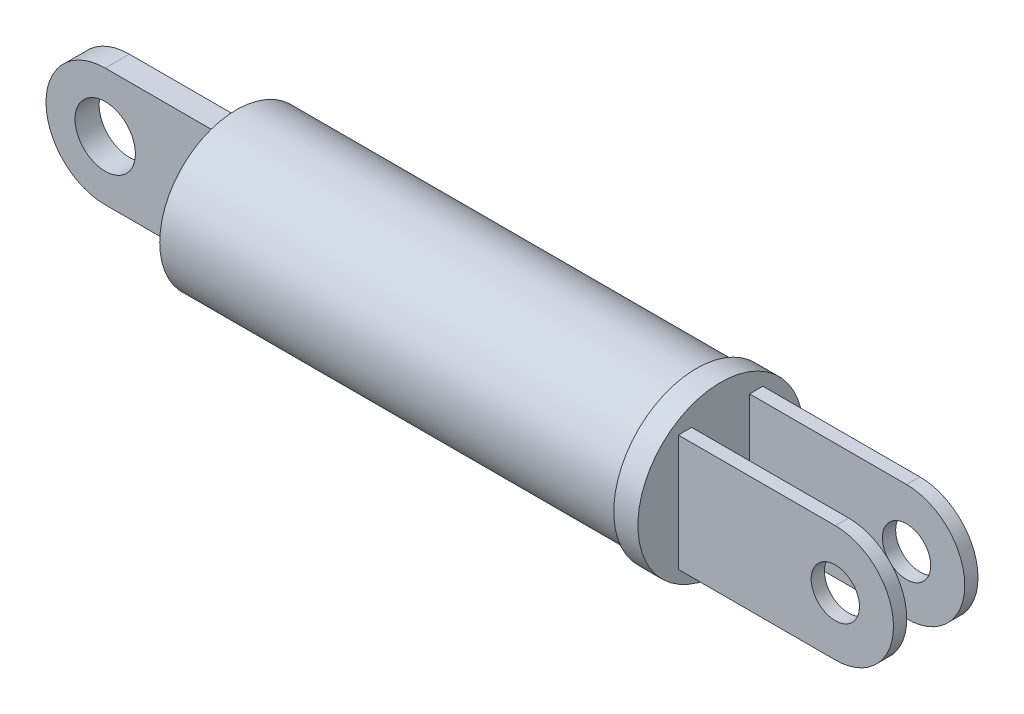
SolidWorks part; units mm, degrees
ref_plane "Front Plane" through (0, 0, 0) normal (0, 0, 1) x (1, 0, 0)
ref_plane "Top Plane" through (0, 0, 0) normal (0, 1, 0) x (1, 0, 0)
ref_plane "Right Plane" through (0, 0, 0) normal (1, 0, 0) x (0, 0, -1)
sketch "Sketch1" plane through (0, 0, 0) normal (1, 0, 0) x (0, 0, -1)
  circle A0 centre (0, 0) radius 12.7
  dimension "D1" = 25.4
extrude "Extrude1" add sketch "Sketch1" along normal blind 76.2
sketch "Sketch2" plane through (0, 0, 0) normal (0, 0, 1) x (1, 0, 0)
  line L0 (0, 0) -> (-32.8673, 0) construction
  line L1 (15.07, 0) -> (-15.07, 0) construction
  line L2 (0, 9.8057) -> (-19.7331, 9.8057)
  line L3 (0, 12.7) -> (0, -12.7) construction
  line L4 (0, -9.8057) -> (-19.7331, -9.8057)
  line L5 (0, 9.8057) -> (0, -9.8057)
  arc A0 (-19.7331, 9.8057) -> (-19.7331, -9.8057) centre (-19.7331, 0) ccw
  circle A1 centre (-19.7331, 0) radius 5
  dimension "D1" = 10
extrude "Extrude2" add sketch "Sketch2" along normal mid plane 4
sketch "Sketch3" plane through (76.2, 0, 0) normal (1, 0, 0) x (0, 0, -1)
  circle A2 centre (0, 0) radius 13.7
  circle A3 centre (0, 0) radius 13.7
  dimension "D1" = 1
extrude "Extrude3" add sketch "Sketch3" along normal blind 4
sketch "Sketch4" plane through (0, 0, 0) normal (0, 0, 1) x (1, 0, 0)
  line L0 (80.2, 9.6357) -> (106.2, 9.6357)
  line L1 (80.2, -13.7) -> (80.2, 13.7) construction
  line L2 (331.2897, 0) -> (364.956, 0) construction
  line L3 (80.2, -9.6357) -> (106.2, -9.6357)
  line L4 (80.2, 9.6357) -> (80.2, -9.6357)
  arc A0 (106.2, 9.6357) -> (106.2, -9.6357) centre (106.2, 0) cw
  circle A1 centre (106.2, 0) radius 4
  dimension "D1" = 8
  dimension "D2" = 26
extrude "Extrude4" add sketch "Sketch4" along normal mid plane 14
sketch "Sketch5" plane through (0, 0, 0) normal (0, 1, 0) x (1, 0, 0)
  line L0 (302.6802, 0) -> (363.3519, 0) construction
  line L1 (-15.07, 0) -> (15.07, 0) construction
  line L2 (80.2, -13.7) -> (80.2, 13.7) construction
  line L3 (80.2, 4.8012) -> (359.728, 4.8012)
  line L4 (80.2, 4.8012) -> (80.2, -4.8012)
  line L5 (80.2, -4.8012) -> (359.728, -4.8012)
  line L6 (359.728, 4.8012) -> (359.728, -4.8012)
  line L7 (359.728, 0) -> (80.2, 0) construction
extrude "Cut-Extrude1" cut sketch "Sketch5" against normal through all and the other way through all
